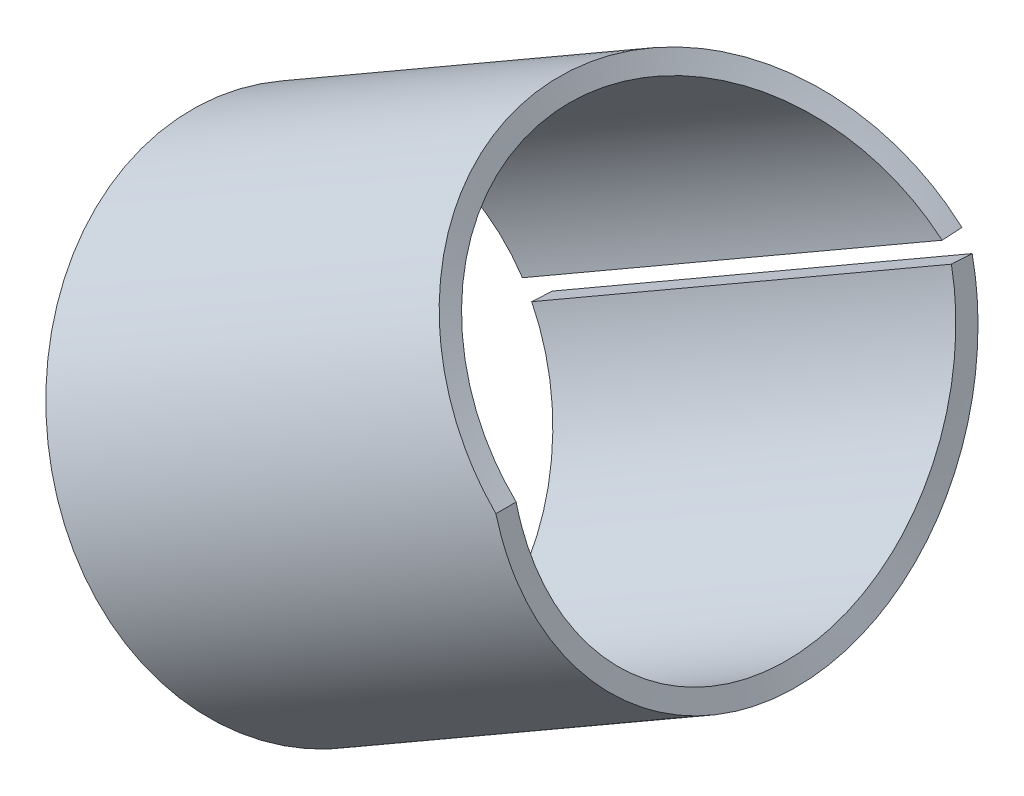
SolidWorks part; units mm, degrees
ref_plane "前视基准面" through (0, 0, 0) normal (0, 0, 1) x (1, 0, 0)
ref_plane "上视基准面" through (0, 0, 0) normal (0, 1, 0) x (1, 0, 0)
ref_plane "右视基准面" through (0, 0, 0) normal (1, 0, 0) x (0, 0, -1)
imported_body "基体零件-带补料的120°Y形三通管-1"
sheet metal parameters "钣金1" parameters "D1"=0.7366, "厚度"=1
bend "圆角折弯1" bend radius 10.6658 bend angle 355.087 parameters "D5"=1
flatten bends "展开-折弯1"
sketch "尖角-草图1" plane through (-24.5567, -13.6005, -11.6551) normal (-0.0214, 0.0371, -0.9991) x (-0.9998, -0.0008, 0.0214)
  line L0 (6.1771, 34.5915) -> (26.8505, 22.6667) construction
  dimension "D1" = 0
process bends "加工-折弯1" parameters "D1"=0
sketch "平面-草图1" plane through (-24.5567, -13.6005, -11.6551) normal (-0.0214, 0.0371, -0.9991) x (-0.9998, -0.0008, 0.0214)
